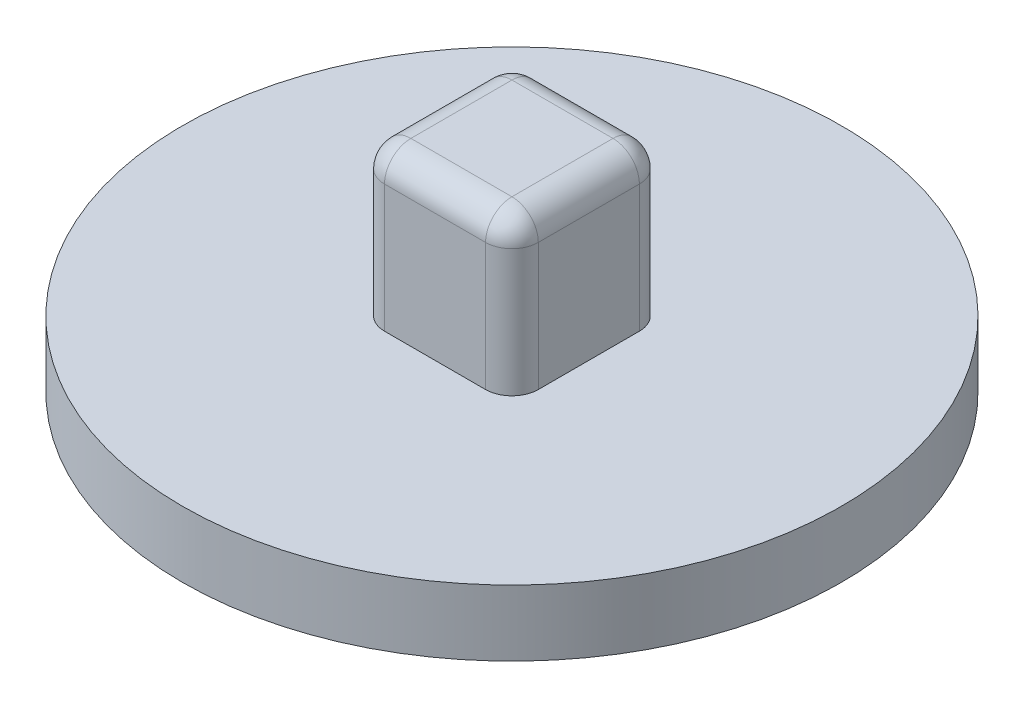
SolidWorks part; units mm, degrees
ref_plane "Front" through (0, 0, 0) normal (0, 0, 1) x (1, 0, 0)
ref_plane "Top" through (0, 0, 0) normal (0, 1, 0) x (1, 0, 0)
ref_plane "Right" through (0, 0, 0) normal (1, 0, 0) x (0, 0, -1)
sketch "Sketch1" plane through (0, 0, 0) normal (0, 1, 0) x (1, 0, 0)
  circle A0 centre (0, 0) radius 75
  dimension "D1" = 150
extrude "Boss-Extrude1" add sketch "Sketch1" along normal blind 15
sketch "Sketch2" plane through (0, 15, 0) normal (0, 1, 0) x (1, 0, 0)
  point P0 (0, 0)
sketch "Sketch24" plane through (-0.4888, 15, 0.2314) normal (0, 1, 0) x (1, 0, 0)
  line L1 (-17.0112, -17.2686) -> (17.9888, -17.2686)
  line L2 (-17.0112, -17.2686) -> (-17.0112, 17.7314)
  line L3 (-17.0112, 17.7314) -> (17.9888, 17.7314)
  line L4 (17.9888, -17.2686) -> (17.9888, 17.7314)
  line L5 (-17.0112, -17.2686) -> (17.9888, 17.7314) construction
  line L6 (-17.0112, 17.7314) -> (17.9888, -17.2686) construction
  point P0 (0.4888, 0.2314)
  dimension "D1" = 35
  dimension "D2" = 35
extrude "Boss-Extrude2" add sketch "Sketch24" along normal blind 35
fillet "Fillet1" radius 6 8 edges at (17.5, 32.5, -17.5) (-17.5, 32.5, -17.5) (-17.5, 32.5, 17.5) (17.5, 32.5, 17.5) (0, 50, 17.5) (-17.5, 50, 0) (0, 50, -17.5) (17.5, 50, 0)
other "Fillet<1>"
